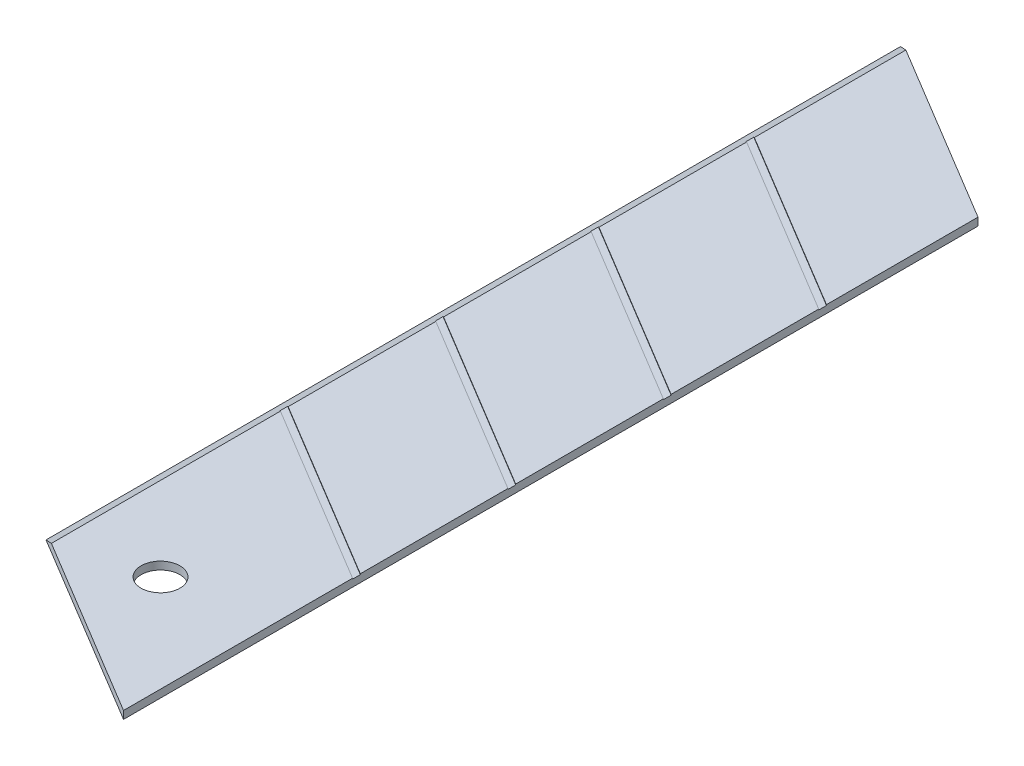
SolidWorks part; units mm, degrees
ref_plane "Plan de face" through (0, 0, 0) normal (0, 0, 1) x (1, 0, 0)
ref_plane "Plan de dessus" through (0, 0, 0) normal (0, 1, 0) x (1, 0, 0)
ref_plane "Plan de droite" through (0, 0, 0) normal (1, 0, 0) x (0, 0, -1)
sketch "Esquisse1" plane through (0, 0, 0) normal (0, 1, 0) x (1, 0, 0)
  line L0 (-12.5, 7.5108) -> (12.5, -7.5108)
  line L1 (-12.5, 117.4892) -> (12.5, 102.4677)
  line L2 (-12.5, 7.5108) -> (-12.5, 117.4892)
  line L3 (12.5, 102.4677) -> (-12.5, 102.4677) construction
  line L4 (12.5, -7.5108) -> (12.5, 102.4677)
  point P5 (0, 0)
  dimension "D1" = 125
  dimension "D2" = 59
  dimension "D3" = 25
extrude "Boss.-Extru.1" add sketch "Esquisse1" against normal blind 1
sketch "Esquisse2" plane through (0, 0, 0) normal (0, 1, 0) x (1, 0, 0)
  line L0 (-12.5, 117.4892) -> (-12.5, 7.5108) construction
  line L1 (12.5, 102.4677) -> (-12.5, 117.4892) construction
  line L2 (-12.5, 7.5108) -> (12.5, -7.5108) construction
  line L3 (12.5, -7.5108) -> (12.5, 102.4677) construction
  line L4 (-12.5, 117.4892) -> (-12.5, 7.5108)
  line L5 (12.5, 102.4677) -> (-12.5, 117.4892)
  line L6 (-12.5, 7.5108) -> (12.5, -7.5108)
  line L7 (12.5, -7.5108) -> (12.5, 102.4677)
  line L8 (-12.5, 97.4892) -> (12.5, 82.4677) construction
  line L9 (-12.5, 77.4892) -> (12.5, 62.4677) construction
  line L10 (-12.5, 57.4892) -> (12.5, 42.4677) construction
  line L11 (0, 77.0419) -> (0, -25) construction
  line L12 (-12.5, 96.9892) -> (12.5, 81.9677)
  line L13 (-12.5, 97.9892) -> (12.5, 82.9677)
  line L14 (-12.5, 77.9892) -> (12.5, 62.9677)
  line L15 (-12.5, 76.9892) -> (12.5, 61.9677)
  line L16 (-12.5, 57.9892) -> (12.5, 42.9677)
  line L17 (-12.5, 56.9892) -> (12.5, 41.9677)
  line L18 (-12.5, 37.4892) -> (12.5, 22.4677) construction
  line L19 (-12.5, 37.9892) -> (12.5, 22.9677)
  line L20 (-12.5, 36.9892) -> (12.5, 21.9677)
  point P12 (0, 109.9785)
  dimension "D1" = 20
  dimension "D2" = 20
  dimension "D3" = 20
  dimension "D4" = 0.5
  dimension "D5" = 0.5
  dimension "D6" = 0.5
  dimension "D7" = 0.5
  dimension "D8" = 0.5
  dimension "D9" = 0.5
  dimension "D10" = 20
  dimension "D11" = 0.5
extrude "Enlèv. mat.-Extru.1" cut sketch "Esquisse2" against normal blind 0.1 contours L17 L7 L16 M1 | L15 L7 L14 M1 | L13 L4 L12 L7 | L20 L7 L19 M1
sketch "Esquisse3" plane through (0, 0, 0) normal (0, 1, 0) x (1, 0, 0)
  line L0 (0, 0) -> (0, 48.5953) construction
  circle A0 centre (0, 9.75) radius 2.5
  dimension "D2" = 5
  dimension "D1" = 9.75
extrude "Enlèv. mat.-Extru.2" cut sketch "Esquisse3" against normal through all
chamfer "Chanfrein1" distance 1 angle 60 1 edges at (-12.5, 0, -22.25)
equation "\"D2@Esquisse2\"=\"D1@Esquisse2\""
equation "\"D3@Esquisse2\"=\"D1@Esquisse2\""
